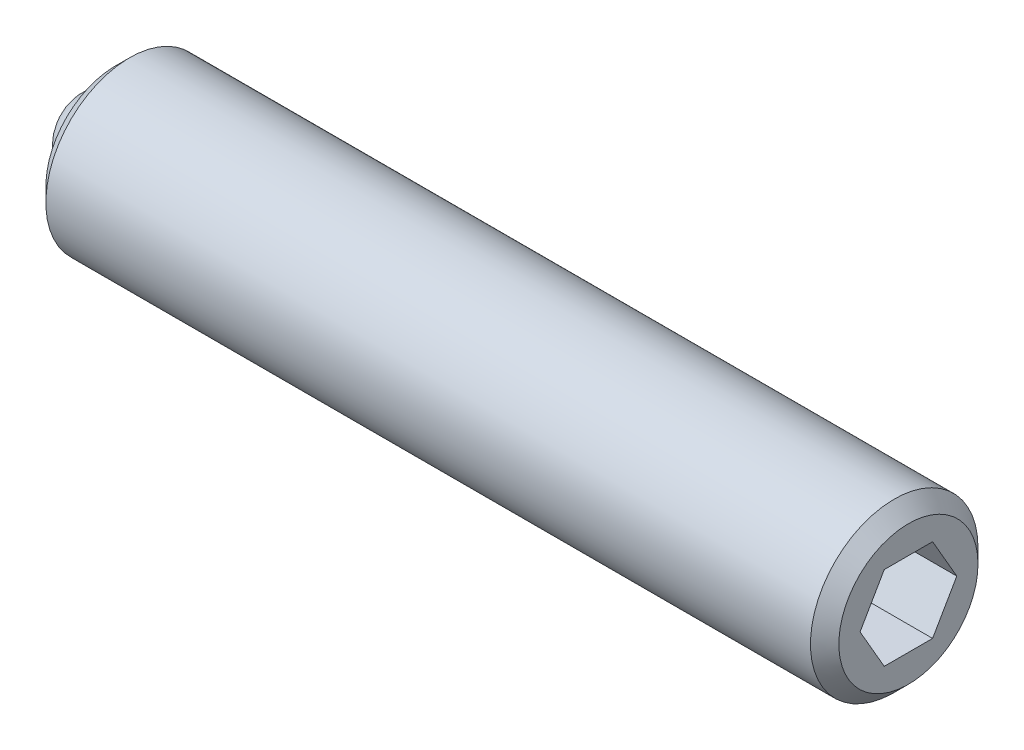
SolidWorks part; units mm, degrees
ref_plane "Front Plane" through (0, 0, 0) normal (0, 0, 1) x (1, 0, 0)
ref_plane "Top Plane" through (0, 0, 0) normal (0, 1, 0) x (1, 0, 0)
ref_plane "Right Plane" through (0, 0, 0) normal (1, 0, 0) x (0, 0, -1)
sketch "Sketch2" plane through (0, 0, 0) normal (1, 0, 0) x (0, 0, -1)
  circle A0 centre (0, 0) radius 1.5
  dimension "D1" = 3
extrude "Boss-Extrude1" add sketch "Sketch2" along normal blind 14.2
sketch "Sketch3" plane through (0, 0, 0) normal (-1, 0, 0) x (0, 0, 1)
  circle A0 centre (0, 0) radius 0.8
  dimension "D1" = 1.6
chamfer "Chamfer1" distance 0.254 angle 45 1 edges at (0, 0, -1.5)
chamfer "Chamfer2" distance 0.254 angle 45 1 edges at (14.2, 0, -1.5)
sketch "Sketch4" plane through (14.2, 0, 0) normal (1, 0, 0) x (0, 0, -1)
  line L1 (0.866, 0) -> (0.433, 0.75)
  line L2 (0.433, 0.75) -> (-0.433, 0.75)
  line L3 (-0.433, 0.75) -> (-0.866, 0)
  line L4 (-0.866, 0) -> (-0.433, -0.75)
  line L5 (-0.433, -0.75) -> (0.433, -0.75)
  line L6 (0.433, -0.75) -> (0.866, 0)
  circle A0 centre (0, 0) radius 0.75 construction
  dimension "D1" = 1.5
extrude "Cut-Extrude2" cut sketch "Sketch4" against normal blind 2
extrude "Cut-Extrude3" cut sketch "Sketch3" against normal blind 0.8
sketch "Sketch5" plane through (0, 0, 0) normal (-1, 0, 0) x (0, 0, 1)
  line L0 (0, 0) -> (0, -0.8)
  line L1 (0, 0) -> (0, 0.8)
  arc A0 (0, 0.8) -> (0, -0.8) centre (0, 0) ccw
  dimension "D1" = 0.8
revolve "Revolve1" add sketch "Sketch5" angle 360 about L1
sketch "Sketch7" plane through (0, 0, 0) normal (-1, 0, 0) x (0, 0, 1)
  line L0 (0, 0) -> (0, 0.8) construction
  arc A0 (0.0634, 0.7975) -> (-0.0634, 0.7975) centre (0, 0) ccw
  arc A1 (0.0634, 0.7975) -> (-0.0634, 0.7975) centre (0, 0.8) ccw
  dimension "D1" = 1.6
  dimension "D2" = 0.127
extrude "Cut-Extrude4" cut sketch "Sketch7" against normal up to surface (0.8 mm away) contours A1 A0
